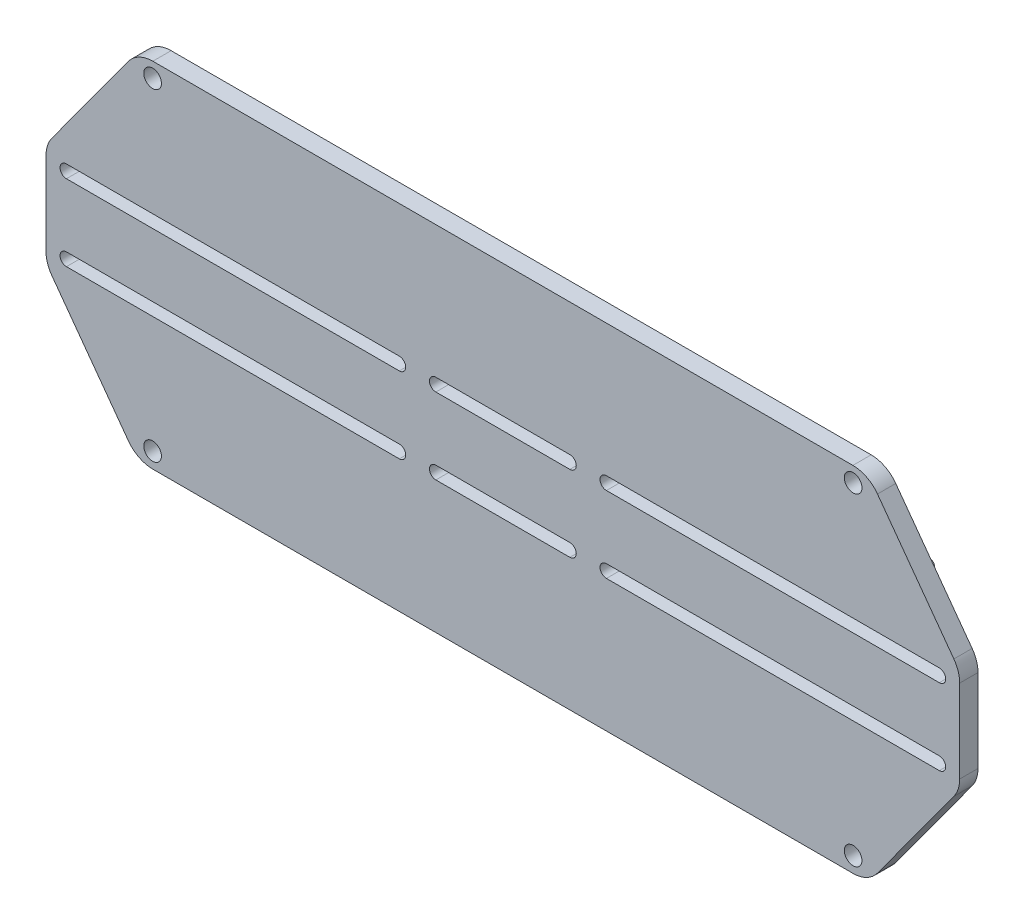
SolidWorks part; units mm, degrees
ref_plane "Front Plane" through (0, 0, 0) normal (0, 0, 1) x (1, 0, 0)
ref_plane "Top Plane" through (0, 0, 0) normal (0, 1, 0) x (1, 0, 0)
ref_plane "Right Plane" through (0, 0, 0) normal (1, 0, 0) x (0, 0, -1)
sketch "Sketch1" plane through (0, 0, 0) normal (0, 0, 1) x (1, 0, 0)
  line L1 (-60, -29.05) -> (60, -29.05)
  line L3 (-60, 28.95) -> (60, 28.95)
  line L5 (0, -29.05) -> (0, 5.15) construction
  line L6 (-60, 28.95) -> (-75, 8.4)
  line L11 (-71.6481, 5.15) -> (-17, 5.15)
  line L14 (-75, -8.5) -> (-75, 8.4)
  line L16 (75, -8.5) -> (75, 8.4)
  line L17 (-71.6481, 7.25) -> (-17, 7.25)
  line L21 (71.6481, -5.25) -> (17, -5.25)
  line L24 (71.6481, -7.35) -> (17, -7.35)
  line L26 (-75, -8.5) -> (-60, -29.05)
  line L27 (60, 28.95) -> (75, 8.4)
  line L28 (75, -8.5) -> (60, -29.05)
  line L29 (0, -0.05) -> (-75, -0.05) construction
  line L30 (-75, -0.05) -> (0, -0.05) construction
  line L33 (-17, -5.25) -> (-71.6481, -5.25)
  line L34 (-17, -7.35) -> (-71.6481, -7.35)
  line L37 (17, 7.25) -> (71.6481, 7.25)
  line L38 (17, 5.15) -> (71.6481, 5.15)
  line L39 (-11, 7.25) -> (11, 7.25)
  line L40 (11, 5.15) -> (-11, 5.15)
  line L41 (-11, -5.25) -> (11, -5.25)
  line L42 (11, -7.35) -> (-11, -7.35)
  line L43 (11, 6.2) -> (11, -6.3) construction
  line L44 (17, 6.2) -> (17, -6.3) construction
  circle A0 centre (-57.5, 26.5) radius 1.45
  circle A1 centre (-57.5, -26.5) radius 1.45
  circle A2 centre (57.5, 26.5) radius 1.45
  circle A3 centre (57.5, -26.5) radius 1.45
  arc A16 (-71.6481, 7.25) -> (-71.6481, 5.15) centre (-71.6481, 6.2) ccw
  arc A17 (71.6481, 7.25) -> (71.6481, 5.15) centre (71.6481, 6.2) cw
  arc A18 (-71.6481, -7.35) -> (-71.6481, -5.25) centre (-71.6481, -6.3) cw
  arc A19 (71.6481, -7.35) -> (71.6481, -5.25) centre (71.6481, -6.3) ccw
  arc A20 (11, 5.15) -> (11, 7.25) centre (11, 6.2) ccw
  arc A21 (17, 7.25) -> (17, 5.15) centre (17, 6.2) ccw
  arc A22 (-17, 7.25) -> (-17, 5.15) centre (-17, 6.2) cw
  arc A23 (-11, 5.15) -> (-11, 7.25) centre (-11, 6.2) cw
  arc A24 (17, -7.35) -> (17, -5.25) centre (17, -6.3) cw
  arc A25 (11, -5.25) -> (11, -7.35) centre (11, -6.3) cw
  arc A26 (-17, -7.35) -> (-17, -5.25) centre (-17, -6.3) ccw
  arc A27 (-11, -5.25) -> (-11, -7.35) centre (-11, -6.3) ccw
  point P0 (-1.6481, 0)
  point P6 (0, 0)
  point P15 (0, 0)
  point P20 (60, 8.45)
  dimension "D5" = 70
  dimension "D6" = 17
  dimension "D4" = 11
  dimension "D1" = 2.1
  dimension "D2" = 2.1
  dimension "D3" = 150
extrude "Boss-Extrude1" add sketch "Sketch1" along normal blind 3
fillet "Fillet1" radius 5 8 edges at (-60, -29.05, 1.5) (-75, -8.5, 1.5) (-75, 8.4, 1.5) (-60, 28.95, 1.5) (60, -29.05, 1.5) (75, -8.5, 1.5) (75, 8.4, 1.5) (60, 28.95, 1.5)
sketch "Sketch2" plane through (0, 0, 0) normal (0, 0, 1) x (1, 0, 0)
  line L0 (-75, -6.8693) -> (-75, 6.7693) construction
  line L1 (-75, -0.05) -> (75, -0.05) construction
  line L2 (75, -6.8693) -> (75, 6.7693) construction
  line L3 (0, 28.95) -> (0, -29.05) construction
  line L4 (-57.4593, 28.95) -> (57.4593, 28.95) construction
  line L5 (-57.4593, -29.05) -> (57.4593, -29.05) construction
  line L6 (-65, -15.1) -> (65, -13.1) construction
  line L7 (-65, 13) -> (65, 13)
  line L8 (-65, 13) -> (-65, 15)
  line L9 (-65, 15) -> (65, 15)
  line L10 (65, 13) -> (65, 15)
  line L11 (-65, 13) -> (65, 15) construction
  line L12 (-65, 15) -> (65, 13) construction
  line L13 (-65, -13.1) -> (65, -15.1) construction
  line L14 (65, -13.1) -> (65, -15.1)
  line L15 (-65, -15.1) -> (65, -15.1)
  line L16 (-65, -13.1) -> (-65, -15.1)
  line L17 (-65, -13.1) -> (65, -13.1)
  point P13 (0, 14)
  dimension "D1" = 14
  dimension "D2" = 2
  dimension "D3" = 130
extrude "Boss-Extrude2" add sketch "Sketch2" against normal blind 4
fillet "Fillet2" radius 2 12 edges at (-65, -14.1, 0) (-65, 14, 0) (65, 14, 0) (65, -14.1, 0) (0, -13.1, 0) (0, 15, 0) (0, 13, 0) (0, -15.1, 0) (-65, -14.1, -4) (-65, 14, -4) (65, -14.1, -4) (65, 14, -4)
